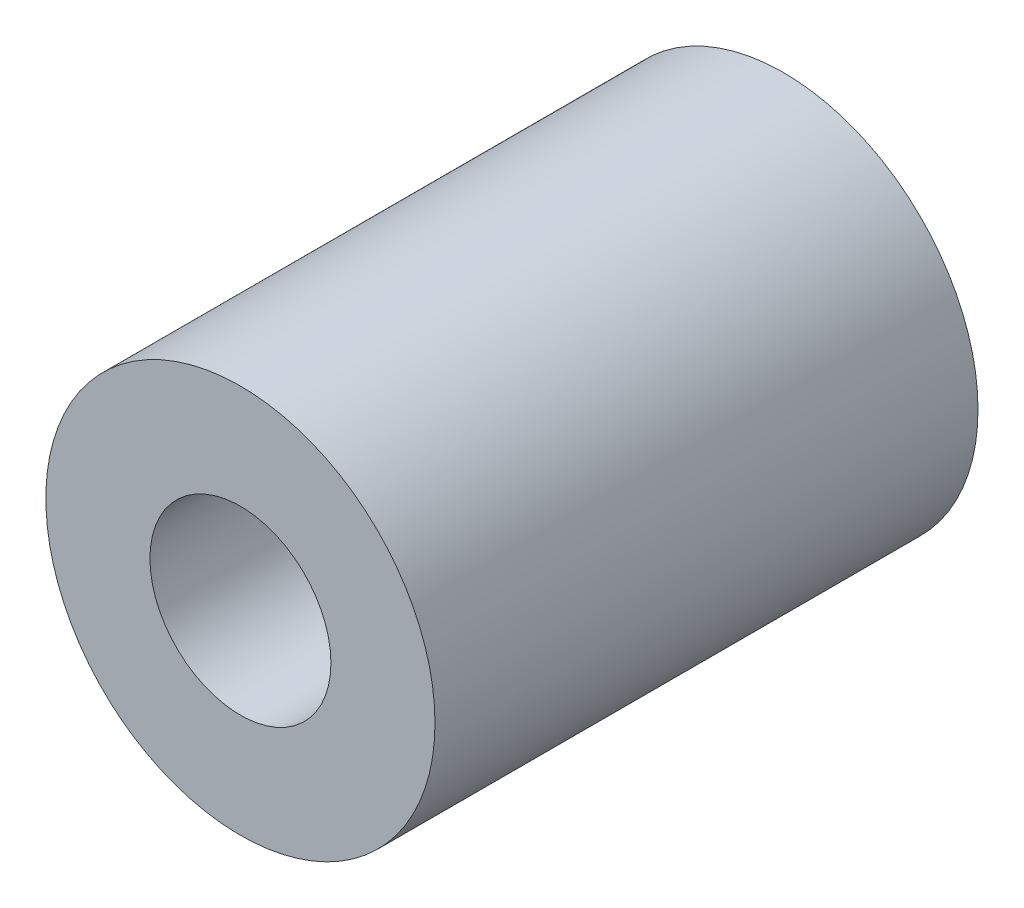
SolidWorks part; units mm, degrees
ref_plane "Face" through (0, 0, 0) normal (0, 0, 1) x (1, 0, 0)
ref_plane "Dessus" through (0, 0, 0) normal (0, 1, 0) x (1, 0, 0)
ref_plane "Droite" through (0, 0, 0) normal (1, 0, 0) x (0, 0, -1)
sketch "Esquisse1" plane through (0, 0, 0) normal (0, 0, 1) x (1, 0, 0)
  circle A0 centre (0, 0) radius 2.15
  circle A1 centre (0, 0) radius 1
  dimension "D1" = 2
  dimension "D2" = 4.3
extrude "Extrusion1" add sketch "Esquisse1" along normal blind 6
